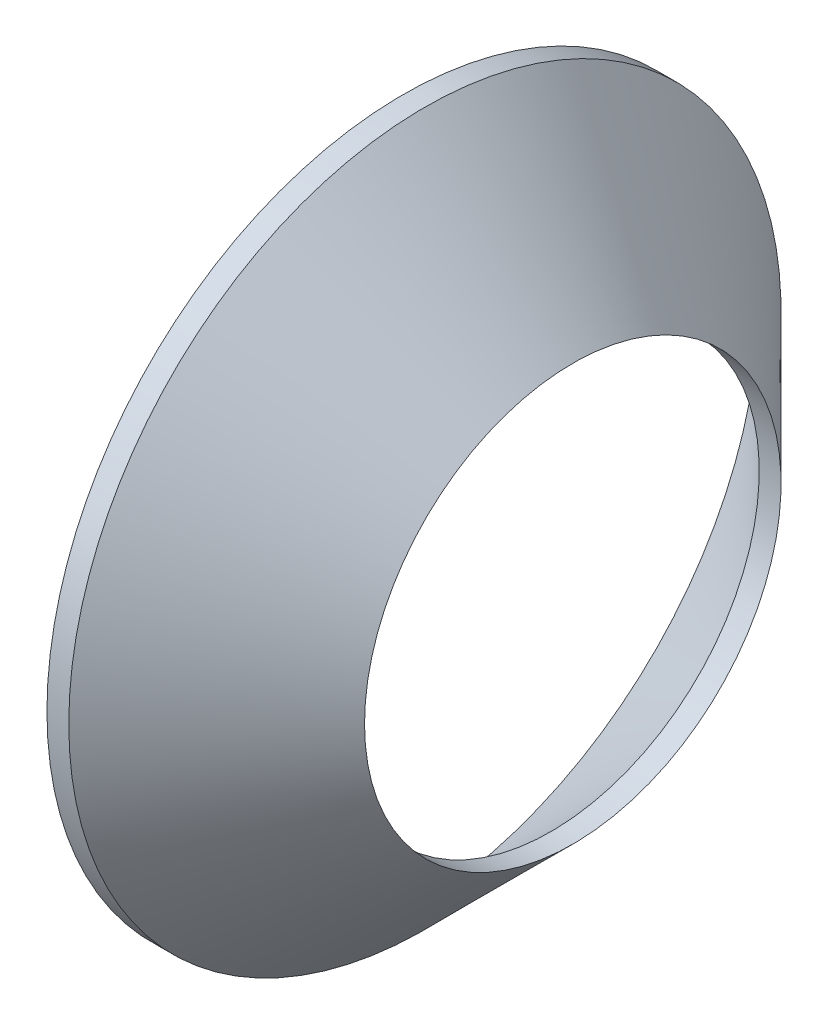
SolidWorks part; units mm, degrees
ref_plane "Face" through (0, 0, 0) normal (0, 0, 1) x (1, 0, 0)
ref_plane "Dessus" through (0, 0, 0) normal (0, 1, 0) x (1, 0, 0)
ref_plane "Droite" through (0, 0, 0) normal (1, 0, 0) x (0, 0, -1)
sketch "Esquisse1" plane through (0, 0, 0) normal (0, 0, 1) x (1, 0, 0)
  line L0 (0, 0) -> (13.8411, 0) construction
  line L1 (0, 11.5429) -> (0.7071, 11.5429)
  line L2 (0.7071, 11.5429) -> (5.5, 6.75)
  line L3 (5.5, 6.75) -> (4.7929, 6.75)
  line L4 (4.7929, 6.75) -> (0, 11.5429)
  line L5 (0, 0) -> (0, 11.7069) construction
  dimension "D1" = 45
  dimension "D2" = 13.5
  dimension "D3" = 5.5
  dimension "D4" = 0.5
revolve "Base-Révolution" add sketch "Esquisse1" angle 360 about L0
